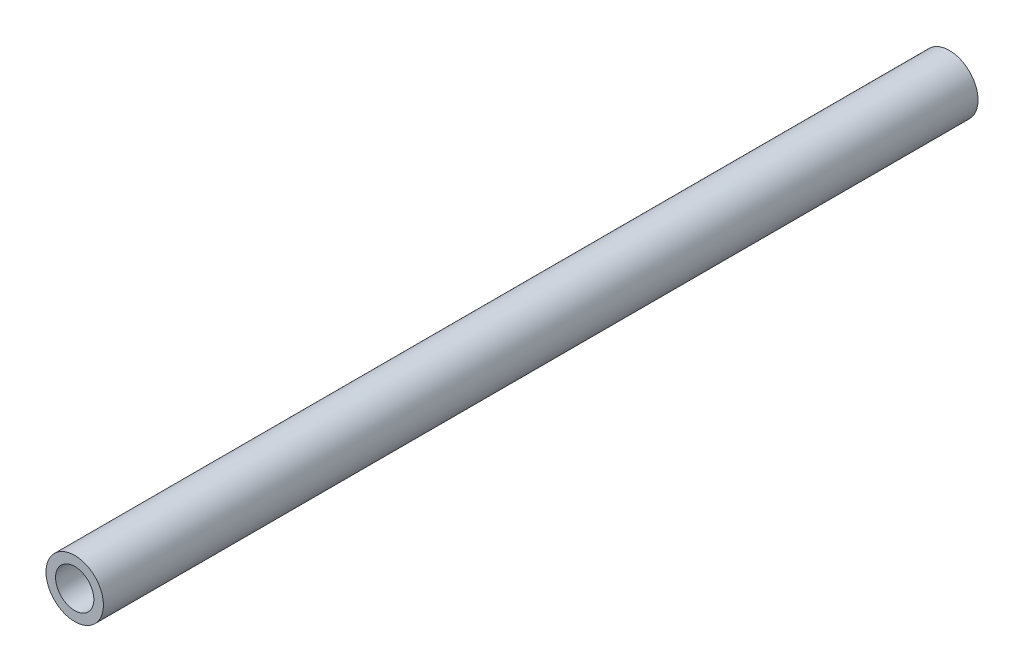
SolidWorks part; units mm, degrees
ref_plane "Plan de face" through (0, 0, 0) normal (0, 0, 1) x (1, 0, 0)
ref_plane "Plan de dessus" through (0, 0, 0) normal (0, 1, 0) x (1, 0, 0)
ref_plane "Plan de droite" through (0, 0, 0) normal (1, 0, 0) x (0, 0, -1)
sketch "Esquisse1" plane through (0, 0, 0) normal (0, 0, 1) x (1, 0, 0)
  circle A0 centre (0, 0) radius 3
  circle A1 centre (0, 0) radius 2
  dimension "D1" = 6
  dimension "D2" = 1
extrude "Boss.-Extru.1" add sketch "Esquisse1" along normal mid plane 91.4
